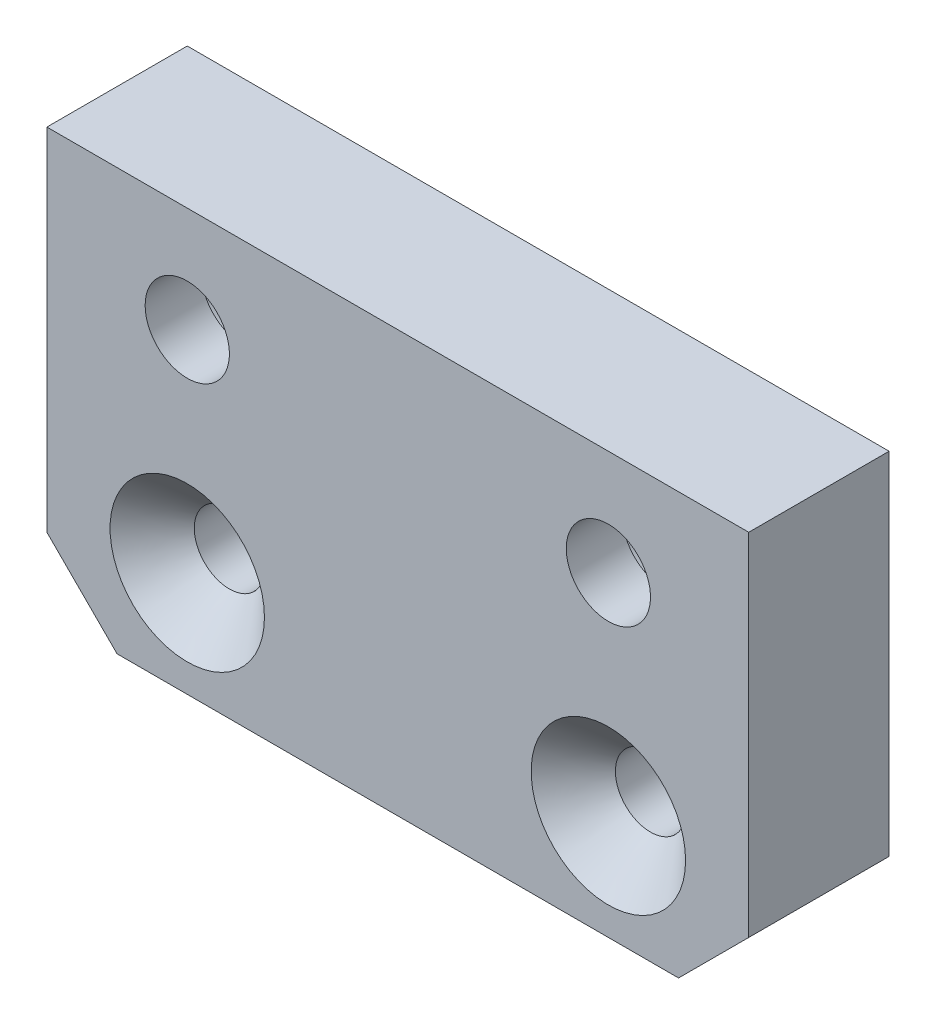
SolidWorks part; units mm, degrees
ref_plane "Plan1" through (0, 0, 0) normal (0, 0, 1) x (1, 0, 0)
ref_plane "plan2" through (0, 0, 0) normal (0, 1, 0) x (1, 0, 0)
ref_plane "Plan3" through (0, 0, 0) normal (1, 0, 0) x (0, 0, -1)
sketch "Esquisse1" plane through (0, 0, 0) normal (0, 0, 1) x (1, 0, 0)
  line L0 (0, -10) -> (0, 78) construction
  line L1 (-25, 0) -> (25, 0)
  line L2 (25, 0) -> (25, 30)
  line L3 (-25, 0) -> (-25, 30)
  line L4 (25, 30) -> (-25, 30)
  point P6 (0, 0)
  point P9 (0, 30)
  dimension "D1" = 30
  dimension "D2" = 50
extrude "Base-Extrusion" add sketch "Esquisse1" along normal blind 10
hole_wizard "Perçage1" positions "Esquisse2" profile "Esquisse3" legacy
sketch "Esquisse2" plane through (0, 0, 10) normal (0, 0, 1) x (1, 0, 0)
  line L0 (25, 0) -> (25, 30) construction
  line L1 (-25, 0) -> (25, 0) construction
  point P0 (15, 7.5)
  dimension "D1" = 10
  dimension "D2" = 7.5
sketch "Esquisse3" plane through (15, 7.5, 10) normal (1, 0, 0) x (0, -1, 0)
  line L0 (0, 0) -> (0, 10)
  line L1 (0, 10) -> (2.5, 10)
  line L2 (2.5, 10) -> (2.5, 3)
  line L3 (2.5, 3) -> (5.5, 0)
  line L4 (5.5, 0) -> (0, 0)
  line L5 (0, -6.4453) -> (0, 115.525) construction
  line L6 (-2.5, 3) -> (-5.5, 0) construction
  dimension "Diamètre" = 5
  dimension "Profondeur" = 10
  dimension "Angle C-Sink" = 90
  dimension "Diamètre C-Sink" = 11
mirror "Symétrie1" about plane through (0, 0, 0) normal (1, 0, 0)
hole_wizard "Perçage2" positions "Esquisse4" profile "Esquisse5" legacy
sketch "Esquisse4" plane through (0, 0, 0) normal (0, 0, -1) x (-1, 0, 0)
  line L0 (-25, 30) -> (25, 30) construction
  line L1 (-25, 0) -> (-25, 30) construction
  point P0 (-15, 22.5)
  dimension "D1" = 7.5
  dimension "D2" = 10
sketch "Esquisse5" plane through (15, 22.5, 0) normal (1, 0, 0) x (0, 1, 0)
  line L0 (0, 0) -> (0, 10)
  line L1 (0, 10) -> (3, 10)
  line L2 (3, 10) -> (3, 6)
  line L3 (3, 6) -> (5.5, 6)
  line L4 (5.5, 6) -> (5.5, 0)
  line L5 (5.5, 0) -> (0, 0)
  line L6 (0, 110) -> (0, -10) construction
  dimension "Diamètre" = 6
  dimension "Profondeur" = 10
  dimension "Diamètre C-Bore" = 11
  dimension "Profondeur C-Bore" = 6
mirror "Symétrie2" about plane through (0, 0, 0) normal (1, 0, 0)
chamfer "Chanfrein1" distance 5 angle 45
